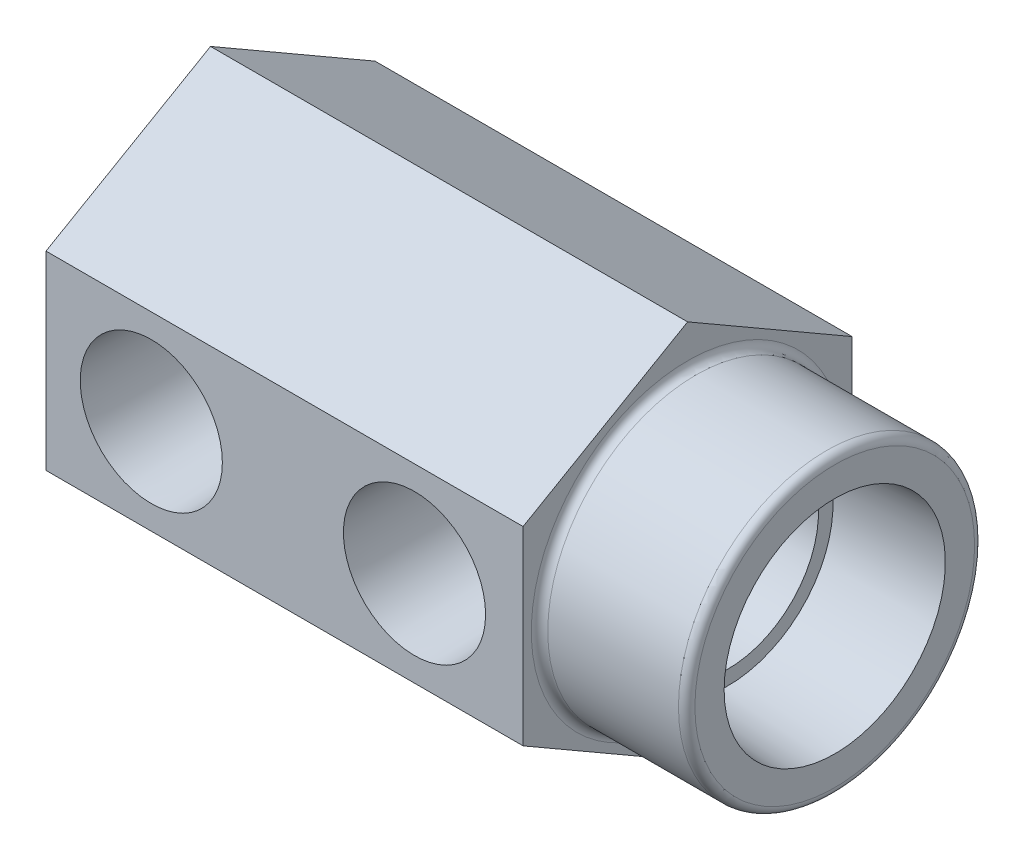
SolidWorks part; units mm, degrees
ref_plane "Front Plane" through (0, 0, 0) normal (0, 0, 1) x (1, 0, 0)
ref_plane "Top Plane" through (0, 0, 0) normal (0, 1, 0) x (1, 0, 0)
ref_plane "Right Plane" through (0, 0, 0) normal (1, 0, 0) x (0, 0, -1)
sketch "Sketch2" plane through (0, 0, 0) normal (1, 0, 0) x (0, 0, -1)
  line L1 (15.875, -9.1654) -> (15.875, 9.1654)
  line L2 (15.875, 9.1654) -> (0, 18.3309)
  line L3 (0, 18.3309) -> (-15.875, 9.1654)
  line L4 (-15.875, 9.1654) -> (-15.875, -9.1654)
  line L5 (-15.875, -9.1654) -> (0, -18.3309)
  line L6 (0, -18.3309) -> (15.875, -9.1654)
  line L7 (0, 20.164) -> (0, -20.164) construction
  circle A0 centre (0, 0) radius 15.875 construction
  dimension "D1" = 31.75
extrude "Boss-Extrude1" add sketch "Sketch2" along normal blind 46.0375 separate body
sketch "Sketch3" plane through (46.0375, 0, 0) normal (1, 0, 0) x (0, 0, -1)
  circle A1 centre (0, 0) radius 14.2875
  dimension "D1" = 28.575
extrude "Boss-Extrude2" add sketch "Sketch3" along normal blind 14.1986
sketch "Sketch5" plane through (0, 0, 0) normal (0, 1, 0) x (1, 0, 0)
  line L0 (-14.0019, 0) -> (49985.9981, 0) construction
  line L12 (49.9364, 8.7312) -> (36.1061, 8.7312)
  line L13 (49.9364, 8.7312) -> (49.9364, 10.1346)
  line L14 (60.2361, 10.6744) -> (49.9364, 10.1346)
  line L15 (60.2361, -14.2875) -> (60.2361, 14.2875) construction
  line L16 (60.2361, 0) -> (60.2361, 10.6744)
  line L18 (36.1061, 0) -> (36.1061, 8.7312)
  line L19 (36.1061, 0) -> (60.2361, 0)
  dimension "D1" = 10.2997
  dimension "D2" = 24.13
  dimension "D5" = 3
  dimension "D8" = 17.4625
  dimension "D11" = 20.2692
revolve "Cut-Revolve1" cut sketch "Sketch5" angle 360 about L0
hole_wizard "1/4 NPT Tapped Hole1" positions "Sketch7" profile "Sketch6" size "1/4" standard "Ansi Inch"
sketch "Sketch7" plane through (0, 0, -15.875) normal (0, 0, -1) x (-1, 0, 0)
  line L0 (17.4625, 0) -> (-17.4625, 0) construction
  line L1 (0, 17.4625) -> (0, -17.4625) construction
  point P0 (-10.16, 0)
  dimension "D1" = 10.16
sketch "Sketch6" plane through (10.16, 0, -15.875) normal (1, 0, 0) x (0, 1, 0)
  line L0 (0, 0) -> (0, 20.4111)
  line L1 (5.5626, 17.0688) -> (0, 20.4111)
  line L2 (-5.5626, 17.0688) -> (0, 20.4111) construction
  line L3 (5.5626, 17.0688) -> (5.5626, 10.0203)
  line L4 (5.5626, 10.0203) -> (6.558, 10.0203)
  line L5 (6.558, 10.0203) -> (6.858, 0)
  line L6 (-6.558, 10.0203) -> (-6.858, 0) construction
  line L7 (6.858, 0) -> (0, 0)
  line L8 (0, -6.35) -> (0, 107.95) construction
  line L11 (-5.5626, 10.0203) -> (-6.558, 10.0203) construction
  dimension "Tap Drill Dia." = 11.1252
  dimension "Tap Drill Depth" = 17.0688
  dimension "Thread Dia." = 13.716
  dimension "Thread Angle" = 3.43
  dimension "Thread Depth" = 10.0203
  dimension "Drill Angle" = 118
hole_wizard "1/4 NPT Tapped Hole2" positions "Sketch9" profile "Sketch8" size "1/4" standard "Ansi Inch"
sketch "Sketch9" plane through (0, 0, 15.875) normal (0, 0, 1) x (1, 0, 0)
  line L0 (0, -17.4625) -> (0, 17.4625) construction
  circle A0 centre (10.16, 0) radius 6.858 construction
  point P0 (10.16, 0)
  point P5 (35.56, 0)
  dimension "D1" = 35.56
sketch "Sketch8" plane through (10.16, 0, 15.875) normal (1, 0, 0) x (0, -1, 0)
  line L0 (0, 0) -> (0, 16.0423)
  line L1 (5.5626, 12.7) -> (0, 16.0423)
  line L2 (-5.5626, 12.7) -> (0, 16.0423) construction
  line L3 (5.5626, 12.7) -> (5.5626, 10.0203)
  line L4 (5.5626, 10.0203) -> (6.558, 10.0203)
  line L5 (6.558, 10.0203) -> (6.858, 0)
  line L6 (-6.558, 10.0203) -> (-6.858, 0) construction
  line L7 (6.858, 0) -> (0, 0)
  line L8 (0, -6.35) -> (0, 107.95) construction
  line L11 (-5.5626, 10.0203) -> (-6.558, 10.0203) construction
  dimension "Tap Drill Dia." = 11.1252
  dimension "Tap Drill Depth" = 12.7
  dimension "Thread Dia." = 13.716
  dimension "Thread Angle" = 3.43
  dimension "Thread Depth" = 10.0203
  dimension "Drill Angle" = 118
fillet "Fillet1" radius 0.7937 2 edges at (60.2361, 0, -14.2875) (46.0375, 0, -14.2875)
hole_wizard "25/64 (0.39063) Diameter Hole1" positions "Sketch13" profile "Sketch12" hole size "25/64" standard "Ansi Inch"
sketch "Sketch13" plane through (60.2361, 0, 0) normal (1, 0, 0) x (0, 0, -1)
  circle A0 centre (0, 0) radius 10.6744 construction
  point P0 (0, 0)
sketch "Sketch12" plane through (60.2361, 0, 0) normal (0, 1, 0) x (0, 0, -1)
  line L0 (0, 0) -> (0, 53.7809)
  line L1 (0, 53.7809) -> (4.961, 50.8)
  line L2 (4.961, 50.8) -> (4.961, 0)
  line L5 (4.961, 0) -> (0, 0)
  line L10 (0, 53.7809) -> (-4.961, 50.8) construction
  line L11 (0, -6.35) -> (0, 107.95) construction
  dimension "Hole Dia." = 9.922
  dimension "Hole Depth" = 50.8
  dimension "Drill Angle" = 118
hole_wizard "7/16 (0.4375) Diameter Hole1" positions "Sketch11" profile "Sketch10" hole size "7/16" standard "Ansi Inch"
sketch "Sketch11" plane through (60.2361, 0, 0) normal (1, 0, 0) x (0, 0, -1)
  circle A0 centre (0, 0) radius 10.6744 construction
  point P0 (0, 0)
sketch "Sketch10" plane through (60.2361, 0, 0) normal (0, 1, 0) x (0, 0, -1)
  line L0 (0, 0) -> (0, 46.2518)
  line L1 (0, 46.2518) -> (5.5562, 42.9133)
  line L2 (5.5562, 42.9133) -> (5.5562, 0)
  line L5 (5.5562, 0) -> (0, 0)
  line L10 (0, 46.2518) -> (-5.5563, 42.9133) construction
  line L11 (0, -6.35) -> (0, 107.95) construction
  dimension "Hole Dia." = 11.1125
  dimension "Hole Depth" = 42.9133
  dimension "Drill Angle" = 118
